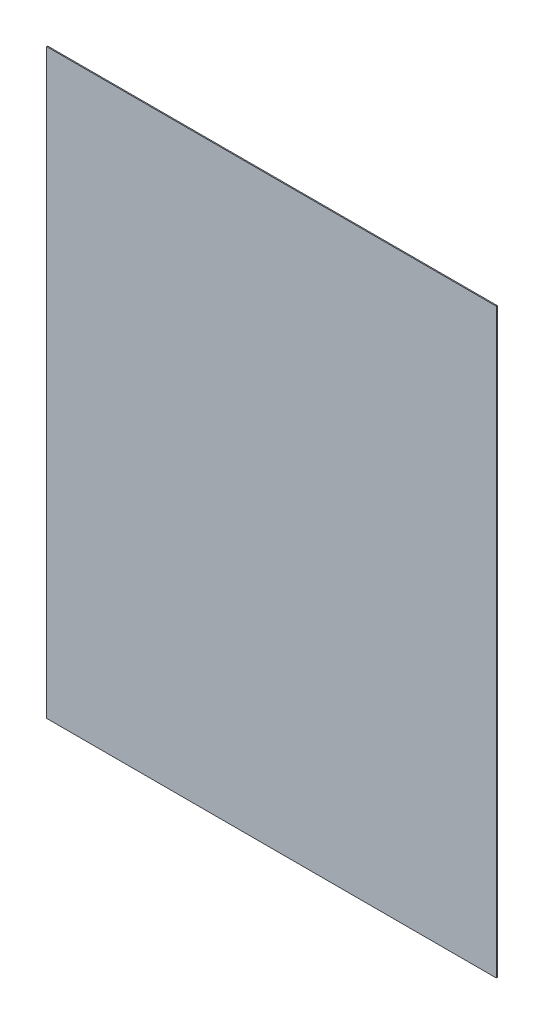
SolidWorks part; units mm, degrees
ref_plane "Front Plane" through (0, 0, 0) normal (0, 0, 1) x (1, 0, 0)
ref_plane "Top Plane" through (0, 0, 0) normal (0, 1, 0) x (1, 0, 0)
ref_plane "Right Plane" through (0, 0, 0) normal (1, 0, 0) x (0, 0, -1)
sketch "Sketch1" plane through (0, 0, 0) normal (0, 0, 1) x (1, 0, 0)
  line L1 (-107.95, -139.7) -> (107.95, -139.7)
  line L2 (-107.95, -139.7) -> (-107.95, 139.7)
  line L3 (-107.95, 139.7) -> (107.95, 139.7)
  line L4 (107.95, -139.7) -> (107.95, 139.7)
  line L5 (-107.95, -139.7) -> (107.95, 139.7) construction
  line L6 (-107.95, 139.7) -> (107.95, -139.7) construction
  point P0 (0, 0)
  dimension "D1" = 215.9
  dimension "D2" = 279.4
extrude "Boss-Extrude1" add sketch "Sketch1" along normal blind 0.5
